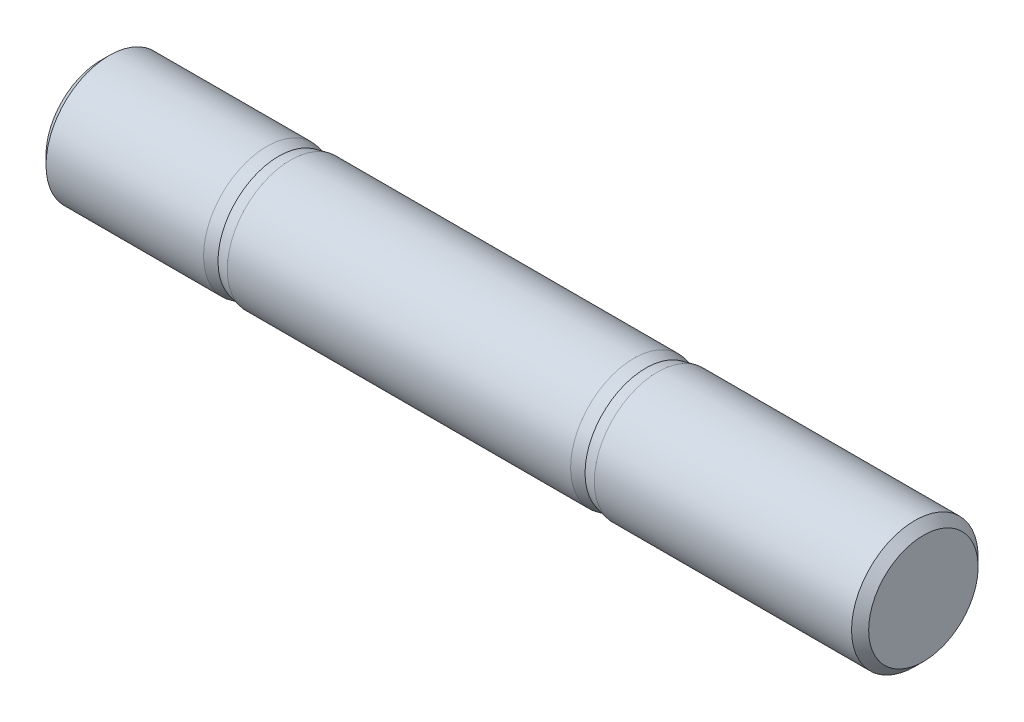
SolidWorks part; units mm, degrees
ref_plane "Front" through (0, 0, 0) normal (0, 0, 1) x (1, 0, 0)
ref_plane "Top" through (0, 0, 0) normal (0, 1, 0) x (1, 0, 0)
ref_plane "Right" through (0, 0, 0) normal (1, 0, 0) x (0, 0, -1)
other "Configuration Table"
sketch "Sketch1" plane through (0, 0, 0) normal (0, 0, 1) x (1, 0, 0)
  line L0 (-1.3108, 0) -> (30.3862, 0) construction
  line L1 (0, 0) -> (0, 10)
  line L2 (0, 10) -> (26.25, 10)
  line L3 (26.25, 10) -> (30, 9.188)
  line L4 (30, 9.188) -> (84.25, 9.188)
  line L5 (84.25, 9.188) -> (88, 10)
  line L6 (88, 10) -> (130, 10)
  line L7 (130, 10) -> (130, 0)
  line L8 (130, 0) -> (0, 0)
revolve "BaseHead" add sketch "Sketch1" angle 360 about L0
chamfer "HeadChamfer" distance 1.353 angle 45 2 edges at (0, 0, 10) (130, 0, 10)
sketch "Sketch2" plane through (0, 0, 0) normal (0, 0, 1) x (1, 0, 0)
  line L0 (-1.3108, 0) -> (31.2107, 0) construction
  line L2 (26.25, 9.188) -> (30, 10)
  line L3 (30, 10) -> (84.25, 10)
  line L4 (84.25, 10) -> (88, 9.188)
  line L7 (26.25, 10) -> (26.25, -10) construction
  line L9 (26.25, 9.188) -> (88, 9.188)
  line L10 (88, 10) -> (88, -10) construction
revolve "BaseBody" add sketch "Sketch2" angle 360 about L0
sketch "Sketch3" plane through (0, 0, 0) normal (0, 0, 1) x (1, 0, 0)
  line L0 (128.647, 8.8283) -> (129.3235, 10)
  line L1 (129.3235, 10) -> (129.3235, 10.5)
  line L2 (129.3235, 10.5) -> (127.9705, 10.5)
  line L3 (127.9705, 10.5) -> (127.9705, 10)
  line L4 (127.9705, 10) -> (128.647, 8.8283)
  line L5 (0, 0) -> (54.5942, 0) construction
  line L6 (128.647, 10) -> (128.647, -10) construction
revolve "Cut-Revolve10" [suppressed] cut sketch "Sketch3" angle 360 about L5
pattern_linear "LPattern10" [suppressed] count 26 spacing 1.6236 along (1, 0, 0)
sketch "Sketch4" plane through (0, 0, 0) normal (0, 0, 1) x (1, 0, 0)
  line L0 (1.353, 8.8283) -> (2.0295, 10)
  line L1 (2.0295, 10) -> (2.0295, 10.5)
  line L2 (2.0295, 10.5) -> (0.6765, 10.5)
  line L3 (0.6765, 10.5) -> (0.6765, 10)
  line L4 (0.6765, 10) -> (1.353, 8.8283)
  line L5 (0, 0) -> (16.1581, 0) construction
  line L6 (0, 8.647) -> (0, -8.647) construction
  line L7 (1.353, 10) -> (1.353, -10) construction
revolve "Cut-Revolve11" [suppressed] cut sketch "Sketch4" angle 360 about L5
pattern_linear "LPattern11" [suppressed] count 16 spacing 1.6236 along (1, 0, 0)
equation "\"D2@Sketch1\" = \"X@Sketch1\""
equation "\"D2@ThreadCosmetic2\" = \"D2@ThreadCosmetic1\""
equation "\"D1@ThreadCosmetic1\" = \"bm@Sketch1\"-\"X@Sketch1\""
equation "\"b@ThreadCosmetic2\" = \"b@Sketch1\""
equation "\"D1@Sketch2\" = \"X@Sketch1\""
equation "\"D2@Sketch2\" = \"d@Sketch1\""
equation "\"D1@HeadChamfer\" =  ( \"d@Sketch1\" - \"D2@ThreadCosmetic1\" )  / 2"
equation "\"D5@Sketch3\" = \"d@Sketch1\""
equation "\"D4@Sketch3\" = (  \"d@Sketch1\" - \"D2@ThreadCosmetic2\" )  / 2"
equation "\"D3@LPattern10\" = \"D4@Sketch3\" * 1.2"
equation "\"D1@LPattern10\" = \"b@ThreadCosmetic2\" / \"D3@LPattern10\""
equation "\"D5@Sketch4\" = \"d@Sketch1\""
equation "\"D4@Sketch4\" = (  \"d@Sketch1\" - \"D2@ThreadCosmetic1\" )  / 2"
equation "\"D3@LPattern11\" = \"D4@Sketch4\" * 1.2"
equation "\"D1@LPattern11\" = \"D1@ThreadCosmetic1\" / \"D3@LPattern11\""
